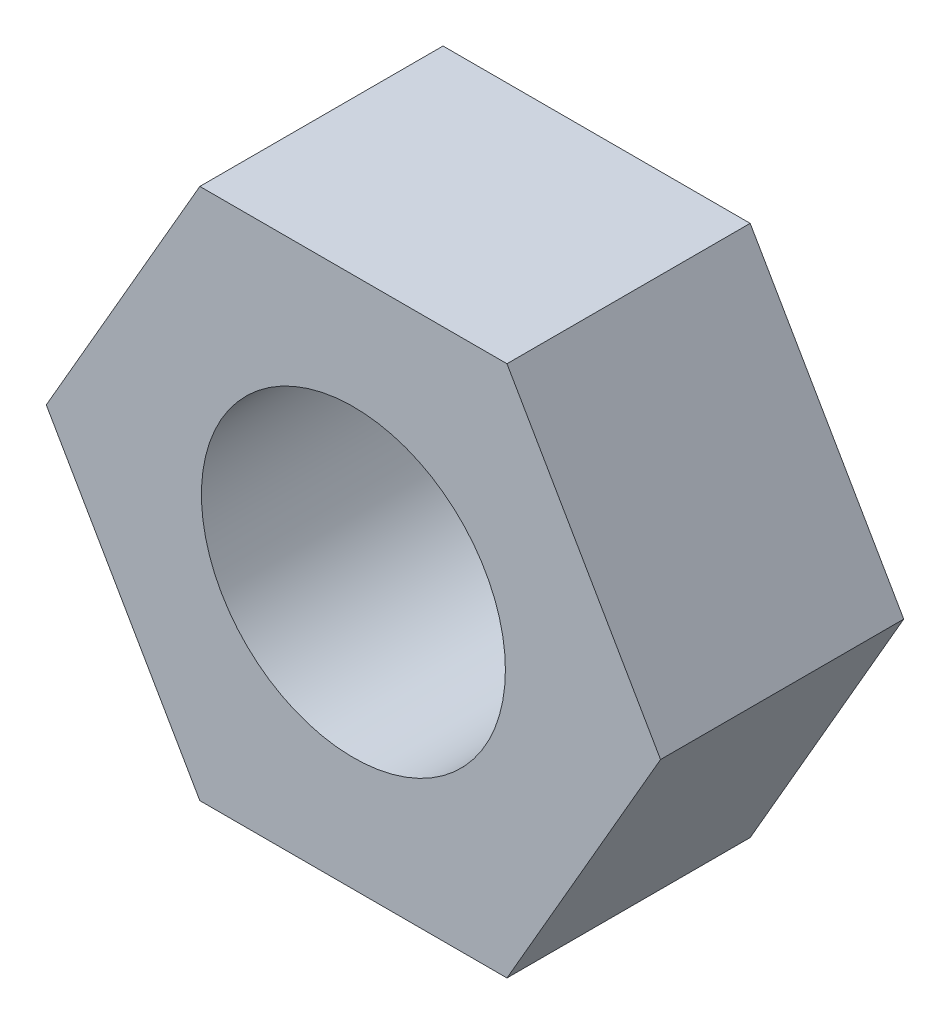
SolidWorks part; units mm, degrees
ref_plane "前视基准面" through (0, 0, 0) normal (0, 0, 1) x (1, 0, 0)
ref_plane "上视基准面" through (0, 0, 0) normal (0, 1, 0) x (1, 0, 0)
ref_plane "右视基准面" through (0, 0, 0) normal (1, 0, 0) x (0, 0, -1)
sketch "草图1" plane through (0, 0, 0) normal (0, 0, 1) x (1, 0, 0)
  line L1 (4.0415, 0) -> (2.0207, 3.5)
  line L2 (2.0207, 3.5) -> (-2.0207, 3.5)
  line L3 (-2.0207, 3.5) -> (-4.0415, 0)
  line L4 (-4.0415, 0) -> (-2.0207, -3.5)
  line L5 (-2.0207, -3.5) -> (2.0207, -3.5)
  line L6 (2.0207, -3.5) -> (4.0415, 0)
  circle A0 centre (0, 0) radius 3.5 construction
  circle A1 centre (0, 0) radius 2
  dimension "对边距离" = 7
  dimension "螺纹直径" = 4
extrude "凸台-拉伸1" add sketch "草图1" along normal mid plane 3.2
